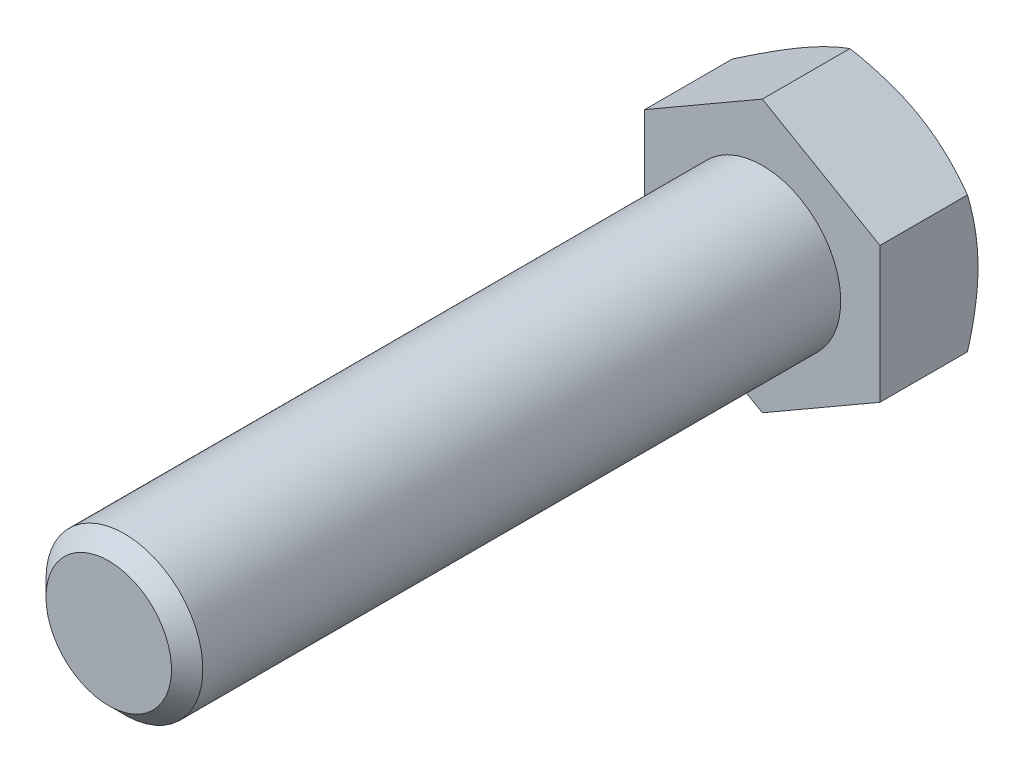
SolidWorks part; units mm, degrees
ref_plane "Plan de face" through (0, 0, 0) normal (0, 0, 1) x (1, 0, 0)
ref_plane "Plan de dessus" through (0, 0, 0) normal (0, 1, 0) x (1, 0, 0)
ref_plane "Plan de droite" through (0, 0, 0) normal (1, 0, 0) x (0, 0, -1)
mirrored part "Vis H M12 - 50 din 931_Rendre symétrique"
other "<Vis H M12 - 50 din 931>-<Enlèvement de matière-Révolution1>"
